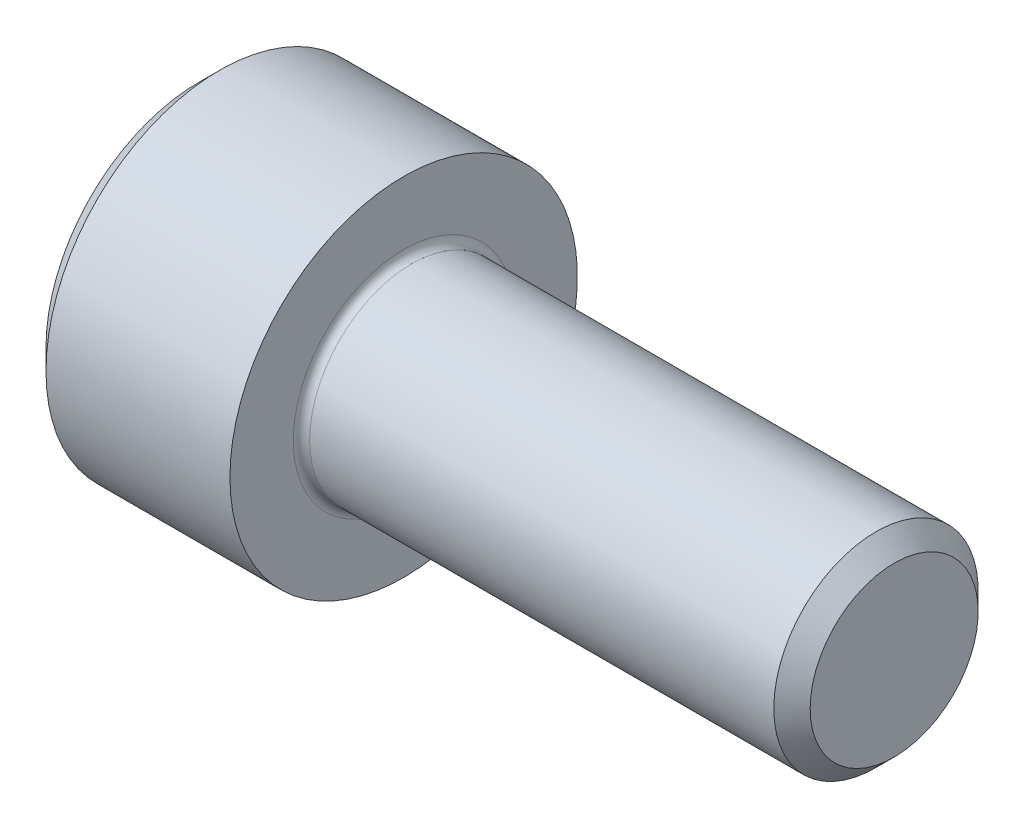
SolidWorks part; units mm, degrees
ref_plane "Plane1" through (0, 0, 0) normal (0, 0, 1) x (1, 0, 0)
ref_plane "Plane2" through (0, 0, 0) normal (0, 1, 0) x (1, 0, 0)
ref_plane "Plane3" through (0, 0, 0) normal (1, 0, 0) x (0, 0, -1)
revolve "Base-Revolve" add sketch "BodySke"
sketch "BodySke" plane through (0, 0, 0) normal (0, 0, 1) x (1, 0, 0)
  line L0 (0, 0) -> (0, 3.75)
  line L1 (0.5, 4.25) -> (5, 4.25)
  line L2 (5, 4.25) -> (5, 2.5)
  line L3 (5, 2.5) -> (16.555, 2.5)
  line L4 (17, 2.055) -> (17, 0)
  line L5 (17, 0) -> (0, 0)
  line L6 (-31.75, 0) -> (127, 0) construction
  line L7 (0, 3.75) -> (0.5, 4.25)
  line L8 (17, 2.055) -> (16.555, 2.5)
  line L9 (0, -3.75) -> (0.5, -4.25) construction
  line L10 (17, -2.055) -> (16.555, -2.5) construction
  line L11 (5.8, 9.525) -> (5.8, 3.175) construction
  line L12 (5, 9.525) -> (5, 3.175) construction
  line L13 (-33, 9.525) -> (-33, 3.175) construction
  dimension "Diameter" = 5
  dimension "Head_ht" = 5
  dimension "Length" = 12
  dimension "Body_ch_ang" = 45
  dimension "Head_dia" = 8.5
  dimension "Head_ch_ang" = 45
  dimension "Minor_dia" = 4.11
  dimension "Advance" = 0.8
  dimension "Thread_nom" = 12
  dimension "Thread_length" = 50
  dimension "Head_ch_ht" = 0.5
fillet "Fillet1" radius 0.2 1 edges at (5, 0, 2.5)
sketch "Sketch2" plane through (0, 0, 0) normal (0, 0, 1) x (1, 0, 0)
  line L0 (0, 2.042) -> (2.5, 2.042)
  line L1 (2.5, 2.042) -> (3.6789, 0)
  line L2 (-31.75, 0) -> (127, 0) construction
  line L3 (3.6789, 0) -> (0, 0)
  line L4 (0, 0) -> (0, 2.042)
  line L5 (0, 3.75) -> (0, -3.75) construction
  line L6 (0, 0) -> (47.625, 0) construction
  line L7 (5, -4.25) -> (5, 4.25) construction
  dimension "D1" = 2.042
  dimension "D2" = 60
  dimension "Wall_thickness" = 2.5
revolve "Hex-PreBroach" cut sketch "Sketch2" angle 360 about L6
sketch "Sketch3" plane through (0, 0, 0) normal (-1, 0, 0) x (0, 0.5, 0.866)
  line L0 (1.1789, 2.042) -> (-1.1789, 2.042)
  line L1 (-1.1789, 2.042) -> (-2.3579, 0)
  line L2 (1.1789, 2.042) -> (2.3579, 0)
  line L3 (1.1789, -2.042) -> (2.3579, 0)
  line L4 (1.1789, -2.042) -> (-1.1789, -2.042)
  line L5 (-1.1789, -2.042) -> (-2.3579, 0)
  dimension "D1" = 2.042
  dimension "D2" = 2.042
  dimension "Hex_size" = 4.084
extrude "Hex" cut sketch "Sketch3" against normal blind 2.5
sketch "Sketch4" plane through (0, 0, 0) normal (-1, 0, 0) x (0, 0, 1)
  line L0 (0, 0) -> (2.3876, 0)
  line L1 (0, 0) -> (6.1484, 3.5498) construction
  line L2 (0, 0) -> (1.1938, 2.0677)
  line L3 (1.9883, 0.576) -> (2.2704, 0.7389)
  line L4 (1.493, 1.4339) -> (1.7751, 1.5968)
  arc A0 (1.9883, 0.576) -> (1.493, 1.4339) centre (0, 0) ccw
  arc A1 (2.3876, 0) -> (2.2704, 0.7389) centre (0, 0) ccw
  arc A2 (1.1938, 2.0677) -> (1.7751, 1.5968) centre (0, 0) cw
  dimension "D1" = 30
  dimension "Spline_n_dim" = 4.1402
  dimension "Spline_m_dim" = 4.7752
  dimension "D2" = 60
  dimension "D3" = 0.4953
  dimension "Spline_p_dim" = 0.9906
extrude "Spline" cut sketch "Sketch4" against normal blind 2.5
pattern_circular "CirPattern1" count 6 every 60
sketch "Sketch5" plane through (0, 0, 0) normal (0, 0, 1) x (1, 0, 0)
  line L0 (-31.75, 0) -> (127, 0) construction
  line L2 (0, 3.75) -> (0, -3.75) construction
  circle A0 centre (2, 0) radius 0.675
  dimension "Drilled_hole_dia" = 1.35
  dimension "Drilled_hole_loc" = 2
extrude "Hole" cut sketch "Sketch5" against normal through all and the other way through all
pattern_circular "Drilled-4" count 2 every 60
pattern_circular "Drilled-6" count 3 every 60
sketch "ThdSchSke" plane through (0, 0, 0) normal (0, 0, 1) x (1, 0, 0)
  line L0 (5.8, -2.055) -> (5.4884, -2.5)
  line L1 (5.8, -2.055) -> (6.1116, -2.5)
  line L2 (6.1116, -2.5) -> (6.1116, -3.125)
  line L3 (-3.175, 0) -> (5.1513, 0) construction
  line L5 (6.1116, -3.125) -> (5.4884, -3.125)
  line L6 (5.4884, -3.125) -> (5.4884, -2.5)
  line L7 (0, 3.75) -> (0, -3.75) construction
  dimension "Thread_minor" = 4.11
  dimension "Diameter" = 5
  dimension "Start" = 5.8
  dimension "SideAngle" = 55
  dimension "VeeAngle" = 70
  dimension "Overcut" = 6.25
revolve "ThreadSchematic" cut sketch "ThdSchSke" angle 360 about L3
pattern_linear "ThdSchPat"
equation "\"D2@Sketch3\" = \"Hex_size@Sketch3\" / 2"
equation "\"D1@Sketch3\" = \"Hex_size@Sketch3\" / 2"
equation "\"D1@Sketch2\" = \"Hex_size@Sketch3\" / 2"
equation "\"D3@Sketch4\" = \"Spline_p_dim@Sketch4\" / 2"
equation "\"Thread_minor@ThreadCosmetic\"  =  \"Minor_dia@BodySke\""
equation "\"D2@CirPattern1\" = 360 / \"Num_teeth@CirPattern1\""
equation "\"Wall_thickness@Sketch2\" = \"Head_ht@BodySke\" - \"Key_eng@Hex\""
equation "\"Thread_length@ThreadCosmetic\" = ((sgn( (\"Length@BodySke\" - \"Advance@BodySke\" ) - \"Thread_nom@BodySke\" )-1)*( (\"Length@BodySke\" - \"Advance@BodySke\" ) - \"Thread_nom@BodySke\" ))/-2+ \"Thread_nom@BodySke\""
equation "\"Thread_minor@ThdSchSke\" = \"Minor_dia@BodySke\""
equation "\"Diameter@ThdSchSke\" = \"Diameter@BodySke\""
equation "\"Overcut@ThdSchSke\" = \"Diameter@BodySke\" * 1.25"
equation "\"Start@ThdSchSke\" = \"Head_ht@BodySke\" + \"Length@BodySke\" - \"Thread_length@ThreadCosmetic\"  '---Non-countersunk---"
equation "\"Num_threads@ThdSchPat\" = int( \"Thread_length@ThreadCosmetic\" / \"Advance@BodySke\" + 0.999 )  + 1"
equation "\"Advance@ThdSchPat\" = \"Thread_length@ThreadCosmetic\" /  (\"Num_threads@ThdSchPat\" - 1) 'relax it"
equation "\"Num_threads@ThdSchPat\" = \"Num_threads@ThdSchPat\" - sgn( \"Num_threads@ThdSchPat\" - 1) '---chamfered tips only---"
